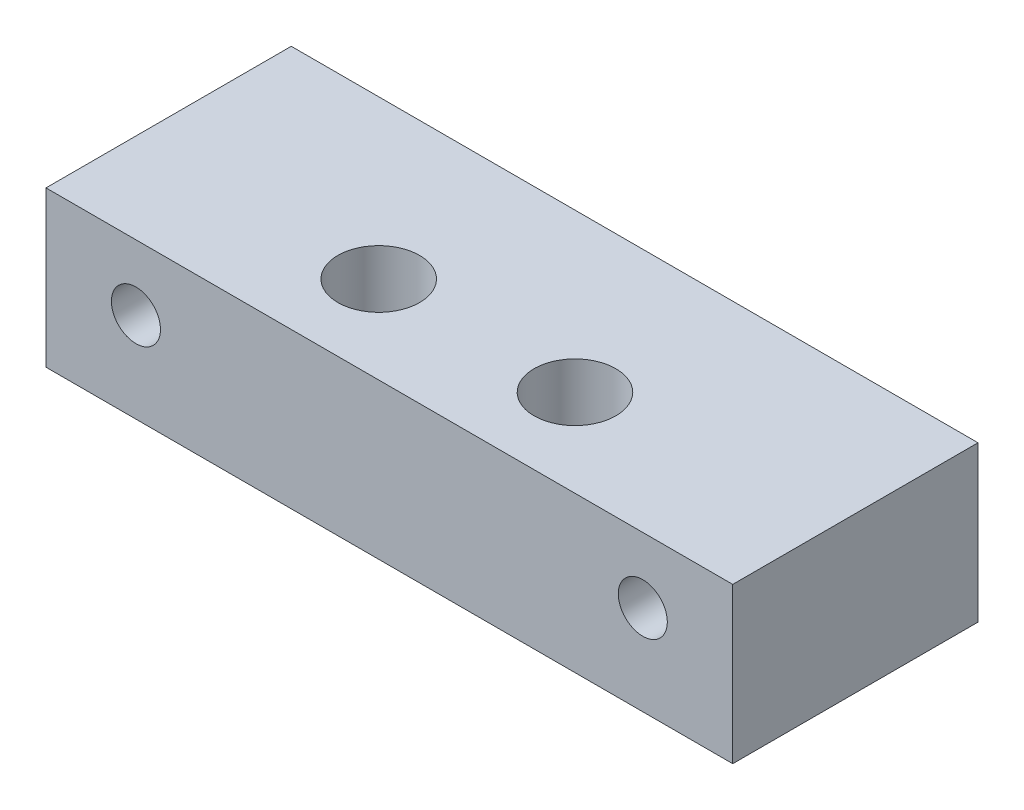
SolidWorks part; units mm, degrees
ref_plane "Front Plane" through (0, 0, 0) normal (0, 0, 1) x (1, 0, 0)
ref_plane "Top Plane" through (0, 0, 0) normal (0, 1, 0) x (1, 0, 0)
ref_plane "Right Plane" through (0, 0, 0) normal (1, 0, 0) x (0, 0, -1)
sketch "Sketch1" plane through (0, 0, 0) normal (0, 1, 0) x (1, 0, 0)
  line L1 (21, -7.5) -> (-21, -7.5)
  line L2 (21, -7.5) -> (21, 7.5)
  line L3 (21, 7.5) -> (-21, 7.5)
  line L4 (-21, -7.5) -> (-21, 7.5)
  line L5 (21, -7.5) -> (-21, 7.5) construction
  line L6 (21, 7.5) -> (-21, -7.5) construction
  point P0 (0, 0)
  dimension "D1" = 42
  dimension "D2" = 15
extrude "Boss-Extrude1" add sketch "Sketch1" along normal blind 9.5
sketch "Sketch2" plane through (0, 9.5, 0) normal (0, 1, 0) x (1, 0, 0)
  line L0 (-21, -2.15) -> (21, -2.15) construction
  line L1 (-21, 7.5) -> (-21, -7.5) construction
  line L2 (21, -7.5) -> (21, 7.5) construction
  line L3 (-21, -7.5) -> (21, -7.5) construction
  circle A0 centre (-6, -2.15) radius 2.5
  circle A1 centre (6, -2.15) radius 2.5
  dimension "D1" = 5
  dimension "D2" = 5
  dimension "D3" = 5.35
  dimension "D4" = 15
  dimension "D5" = 15
extrude "Cut-Extrude1" cut sketch "Sketch2" against normal through all
sketch "Sketch3" plane through (0, 0, 7.5) normal (0, 0, 1) x (1, 0, 0)
  line L0 (-21, 5.5) -> (21, 5.5) construction
  line L1 (-21, 9.5) -> (-21, 0) construction
  line L2 (21, 9.5) -> (21, 0) construction
  line L3 (-21, 9.5) -> (21, 9.5) construction
  circle A0 centre (-15.5, 5.5) radius 1.5
  circle A1 centre (15.5, 5.5) radius 1.5
  dimension "D1" = 3
  dimension "D2" = 3
  dimension "D3" = 5.5
  dimension "D4" = 5.5
  dimension "D5" = 4
extrude "Cut-Extrude2" cut sketch "Sketch3" against normal through all
